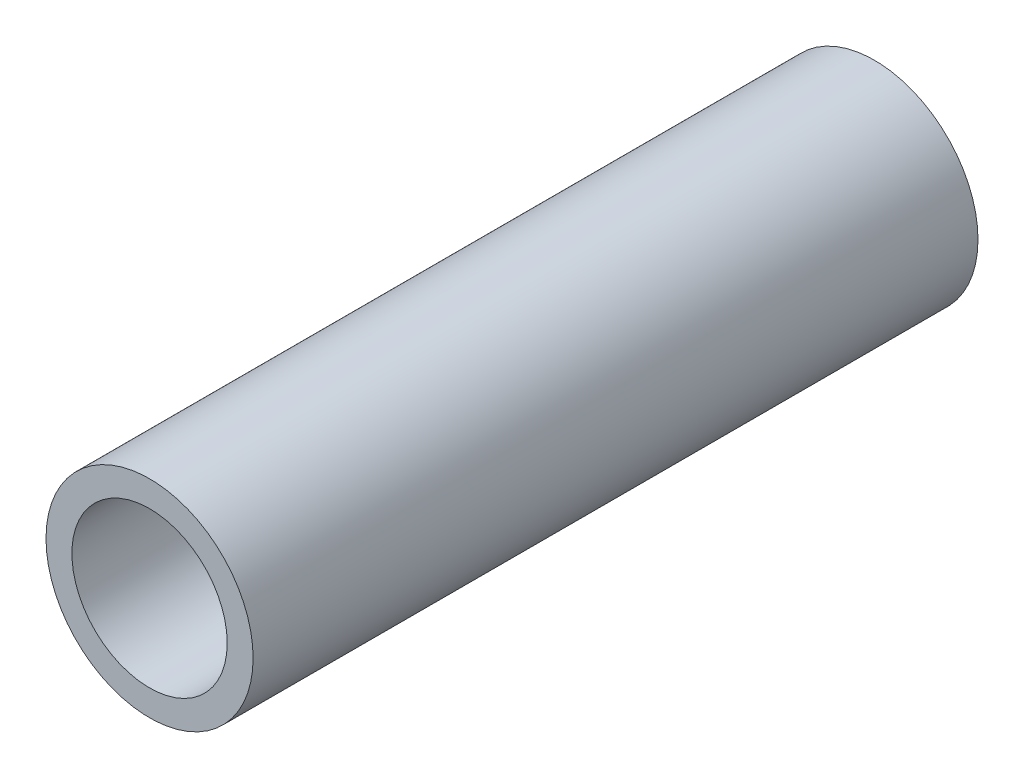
SolidWorks part; units mm, degrees
ref_plane "Front Plane" through (0, 0, 0) normal (0, 0, 1) x (1, 0, 0)
ref_plane "Top Plane" through (0, 0, 0) normal (0, 1, 0) x (1, 0, 0)
ref_plane "Right Plane" through (0, 0, 0) normal (1, 0, 0) x (0, 0, -1)
sketch "Sketch1" plane through (0, 0, 0) normal (0, 1, 0) x (1, 0, 0)
  line L0 (-4.7625, 31.6389) -> (-4.7625, -12.8111)
  line L1 (-6.35, 31.6389) -> (-6.35, -12.8111)
  line L2 (-6.35, 31.6389) -> (-4.7625, 31.6389)
  line L3 (-6.35, -12.8111) -> (-4.7625, -12.8111)
  line L4 (0, -12.8111) -> (0, 31.6389) construction
  dimension "D1" = 1.5875
  dimension "D2" = 4.7625
revolve "Tygon Tubing" add sketch "Sketch1" angle 360 about L4
